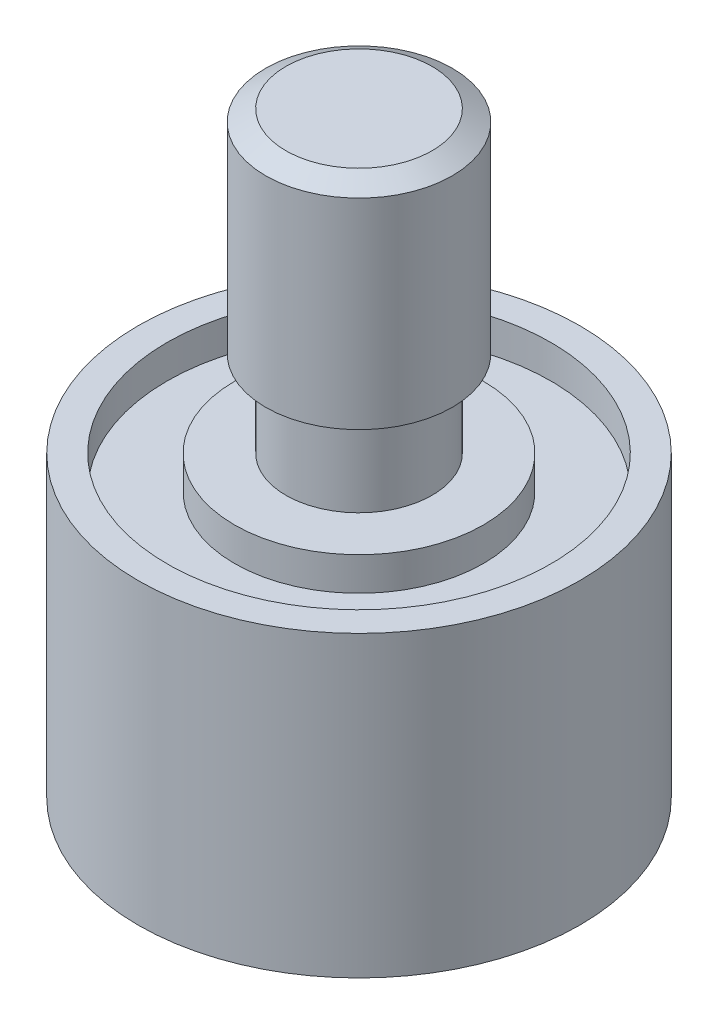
SolidWorks part; units mm, degrees
ref_plane "Front Plane" through (0, 0, 0) normal (0, 0, 1) x (1, 0, 0)
ref_plane "Top Plane" through (0, 0, 0) normal (0, 1, 0) x (1, 0, 0)
ref_plane "Right Plane" through (0, 0, 0) normal (1, 0, 0) x (0, 0, -1)
sketch "Sketch1" plane through (0, 0, 0) normal (0, 0, 1) x (1, 0, 0)
  line L0 (3.1115, 0) -> (5.2959, 0)
  line L1 (5.2959, 0) -> (5.2959, -1.4224)
  line L2 (5.2959, -1.4224) -> (8.1661, -1.4224)
  line L3 (8.1661, -1.4224) -> (8.1661, 0)
  line L4 (8.1661, 0) -> (9.398, 0)
  line L5 (9.398, 0) -> (9.398, -12.7)
  line L6 (9.398, -12.7) -> (0, -12.7)
  line L7 (0, -12.7) -> (0, 0)
  line L8 (3.1115, 0) -> (3.1115, 3.175)
  line L9 (3.1115, 3.175) -> (3.9687, 3.6699)
  line L10 (3.9687, 3.6699) -> (3.9687, 12.2051)
  line L11 (3.9687, 12.2051) -> (3.1115, 12.7)
  line L12 (3.1115, 12.7) -> (0, 12.7)
  line L13 (0, 12.7) -> (0, 0)
  line L14 (0, 0) -> (0, -27.2283) construction
  point P11 (2.5692, 32.0157)
  point P17 (0, 0)
  point P20 (1.8622, 2.7333)
  dimension "D1" = 18.796
  dimension "D2" = 10.5918
  dimension "D3" = 6.223
  dimension "D4" = 7.9375
  dimension "D5" = 2.8702
  dimension "D6" = 12.7
  dimension "D7" = 1.4224
  dimension "D8" = 12.7
  dimension "D9" = 3.175
  dimension "D10" = 60
  dimension "D11" = 30
revolve "Revolve1" add sketch "Sketch1" angle 360 about L14
hole_wizard "#38 (0.1015) Diameter Hole1" positions "Sketch3" profile "Sketch2" hole size "#38" standard "ANSI Inch"
sketch "Sketch3" plane through (0, -12.7, 0) normal (0, -1, 0) x (-1, 0, 0)
  point P0 (-6.3246, 0)
  point P1 (6.3246, 0)
  point P4 (0, 0)
  dimension "D1" = 6.3246
  dimension "D2" = 6.3246
sketch "Sketch2" plane through (6.3246, -12.7, 0) normal (1, 0, 0) x (0, 0, -1)
  line L0 (0, 0) -> (0, 5.3211)
  line L1 (0, 5.3211) -> (1.289, 4.5466)
  line L2 (1.289, 4.5466) -> (1.289, 0)
  line L5 (1.289, 0) -> (0, 0)
  line L10 (0, 5.3211) -> (-1.2891, 4.5466) construction
  line L11 (0, -6.35) -> (0, 107.95) construction
  dimension "Hole Dia." = 2.5781
  dimension "Hole Depth" = 4.5466
  dimension "Drill Angle" = 118
equation "\"Buoyancy\"=\"SW-Volume\"*(\"SW-Density\"-.037062)"
